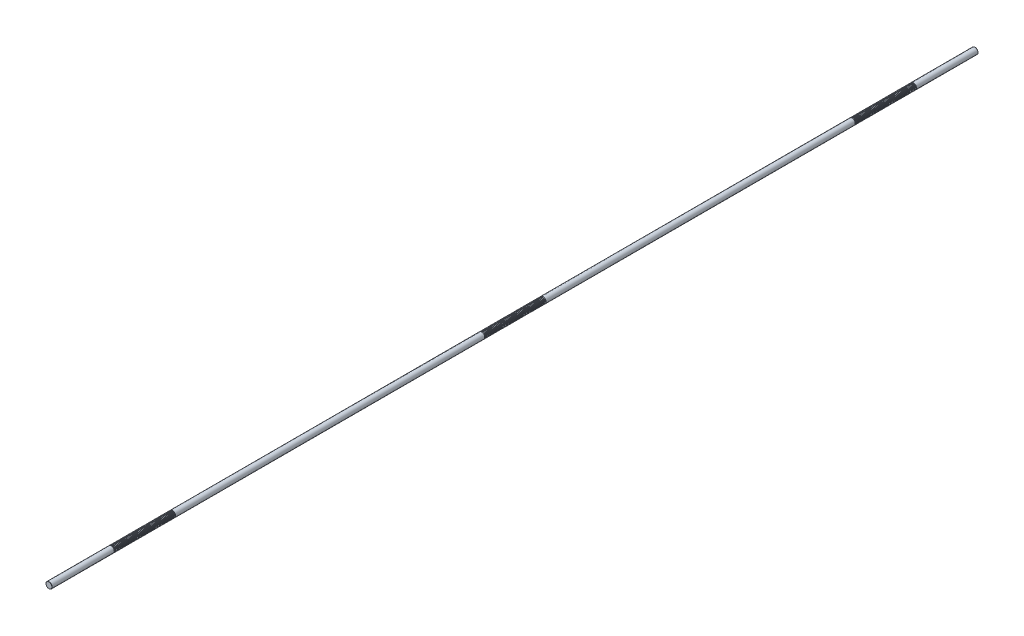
SolidWorks part; units mm, degrees
ref_plane "Front Plane" through (0, 0, 0) normal (0, 0, 1) x (1, 0, 0)
ref_plane "Top Plane" through (0, 0, 0) normal (0, 1, 0) x (1, 0, 0)
ref_plane "Right Plane" through (0, 0, 0) normal (1, 0, 0) x (0, 0, -1)
sketch "Sketch1" plane through (0, 0, 0) normal (0, 0, 1) x (1, 0, 0)
  circle A0 centre (0, 0) radius 5
  dimension "D1" = 10
extrude "Boss-Extrude1" add sketch "Sketch1" along normal mid plane 1500
chamfer "Chamfer1" distance 0.25 angle 45 2 edges at (5, 0, -750) (5, 0, 750)
sketch "Sketch2" plane through (0, 0, 0) normal (1, 0, 0) x (0, 0, -1)
  line L0 (650.1675, 5) -> (648.8325, 5)
  line L1 (749.75, 5) -> (-749.75, 5) construction
  line L2 (648.8325, 5) -> (649.1675, 3.75)
  line L3 (649.1675, 3.75) -> (649.8325, 3.75)
  line L4 (649.8325, 3.75) -> (650.1675, 5)
  line L5 (750, -4.75) -> (750, 4.75) construction
  point P4 (649.5, 5)
  point P7 (649.5, 3.75)
  point P8 (650, 4.375)
  point P9 (649, 4.375)
  dimension "D1" = 1
  dimension "D2" = 100
  dimension "D3" = 1.25
  dimension "D4" = 30
revolve "Cut-Revolve1" cut sketch "Sketch2" angle 360 about axis through (0, 0, 750) along (0, 0, -1)
pattern_linear "LPattern1" count 50 spacing 2 along (0, 0, 1) of "Cut-Revolve1"
pattern_linear "LPattern2" count 3 spacing 600 along (0, 0, 1) of "Cut-Revolve1", "LPattern1"
